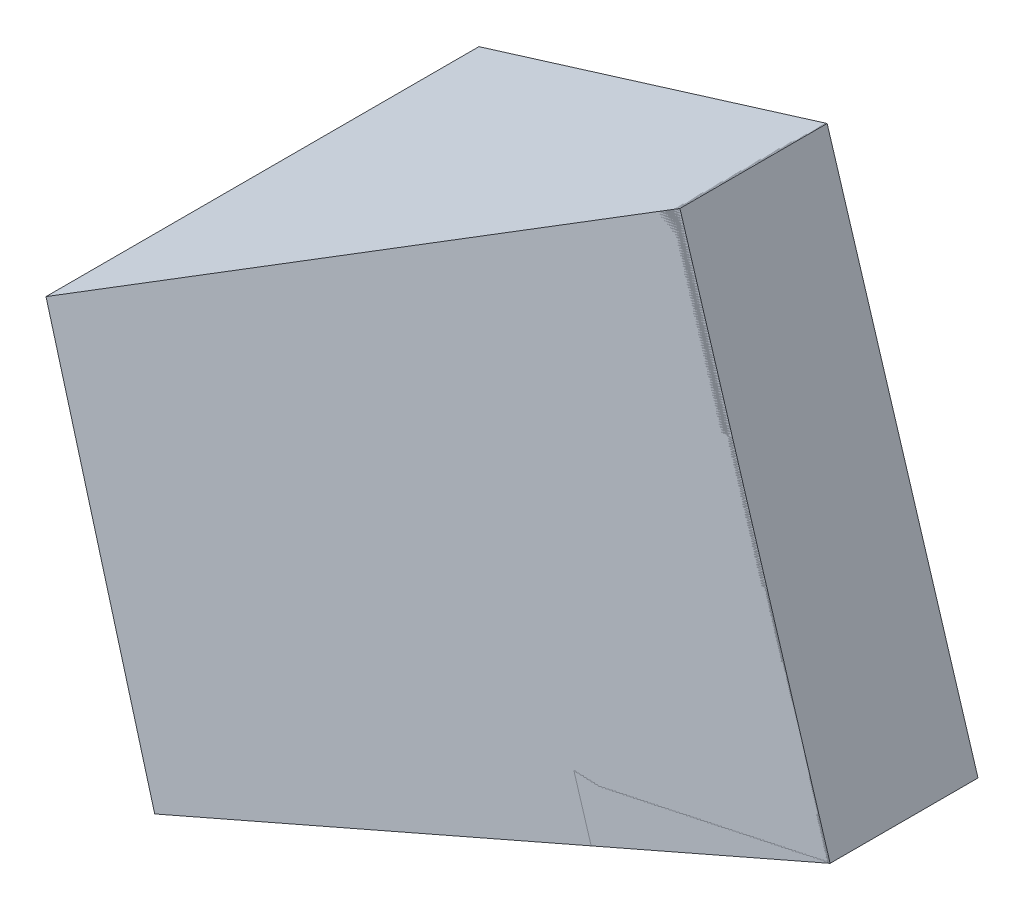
SolidWorks part; units mm, degrees
ref_plane "Ebene Unten" through (0, 0, 0) normal (0, 0, 1) x (1, 0, 0)
ref_plane "Ebene Links" through (0, 0, 0) normal (0, 1, 0) x (1, 0, 0)
ref_plane "Ebene Vorne" through (0, 0, 0) normal (1, 0, 0) x (0, 0, -1)
sketch "Skizze1" plane through (0, 0, 0) normal (0, 0, 1) x (1, 0, 0)
  point P0 (250606.2, 448428.6)
  point P1 (250000, 450000)
  point P2 (249999, 449992.6)
  point P3 (249760.3, 449928.9)
  point P4 (250575.7, 448033.6)
  point P5 (250000.5, 449998.1)
  point P6 (250001.1, 449997)
  point P7 (250001.5, 449996.9)
  point P8 (250001.5, 449996.2)
  point P9 (250001.7, 449995.9)
  point P10 (250001.8, 449994.8)
  point P11 (250002.1, 449992.8)
  point P12 (250002.7, 449993.2)
  point P13 (250018.6, 449926.8)
  point P14 (250088.7, 449685.1)
  point P15 (250158.9, 449444.7)
  point P16 (250229.1, 449204.7)
  point P17 (250299.4, 448964.8)
  point P18 (250369.4, 448724.8)
  point P19 (250439.7, 448484.8)
  point P20 (250510, 448244.8)
  point P21 (250571.6, 448037.1)
  point P22 (250571, 448035.4)
  point P23 (250571.2, 448034.3)
  point P24 (250571.1, 448033.6)
  point P25 (250571, 448033.1)
  point P26 (250571, 448032.8)
  point P27 (250571.3, 448032.3)
  point P28 (250571.5, 448031.8)
  point P29 (250230.1, 449215.3)
  point P30 (250159.8, 449454.9)
  point P31 (250089.5, 449694.2)
  point P32 (250019.3, 449933)
  point P33 (249261.2, 449768.2)
  point P34 (250332.7, 450100)
  point P35 (249500, 449842)
  point P36 (249738.8, 449916.1)
  point P37 (249977.6, 449989.9)
  point P38 (250216.5, 450063.3)
  point P39 (252079.1, 449480)
  point P40 (250390.3, 447750.8)
  point P41 (252152.2, 449241.9)
  point P42 (252226.1, 449003.1)
  point P43 (252297.6, 448763.5)
  point P44 (252371.2, 448524)
  point P45 (252446, 448285)
  point P46 (252434.3, 448059.4)
  point P47 (252185.1, 448055.2)
  point P48 (251938.3, 448050.3)
  point P49 (251688.5, 448046.6)
  point P50 (251434.7, 448044)
  point P51 (251183.8, 448041.7)
  point P52 (250933.7, 448039.4)
  point P53 (250684.2, 448036.8)
  point P54 (250481.1, 447891.8)
  point P55 (250346, 447681.5)
  point P56 (251966.4, 448968.6)
  point P57 (250453, 448500.4)
  point P58 (252214.5, 449044)
  point P59 (252212.5, 449049.2)
  point P60 (252211.8, 449049.5)
  point P61 (252212.5, 449049.7)
  point P62 (252028.4, 448992.7)
  point P63 (251839.8, 448934.3)
  point P64 (251650, 448875.6)
  point P65 (251460, 448816.9)
  point P66 (251272.7, 448758.8)
  point P67 (251084, 448700.5)
  point P68 (250895.3, 448642.1)
  point P69 (250706.4, 448583.7)
  point P70 (250517.9, 448525.3)
  point P71 (250329.8, 448467.2)
  point P72 (250141.4, 448408.9)
  point P73 (249952.8, 448350.6)
  point P74 (249725.4, 448280.3)
  point P75 (249486.5, 448206.4)
  point P76 (249249.6, 448133.2)
  point P77 (249062, 448075.2)
  point P78 (248874.2, 448017.1)
  point P79 (248707.5, 447965.5)
  point P80 (248515, 447905.8)
  point P81 (250606.2, 448428.6)
curve "Importierte Kurve1"
curve "Importierte Kurve2"
curve "Importierte Kurve3"
curve "Importierte Kurve4"
curve "Importierte Kurve5"
curve "Importierte Kurve6"
curve "Importierte Kurve7"
curve "Importierte Kurve8"
curve "Importierte Kurve9"
curve "Importierte Kurve10"
curve "Importierte Kurve11"
curve "Importierte Kurve12"
curve "Importierte Kurve13"
curve "Importierte Kurve14"
curve "Importierte Kurve15"
curve "Importierte Kurve16"
curve "Importierte Kurve17"
curve "Importierte Kurve18"
curve "Importierte Kurve19"
curve "Importierte Kurve20"
curve "Importierte Kurve21"
curve "Importierte Kurve22"
curve "Importierte Kurve23"
curve "Importierte Kurve24"
curve "Importierte Kurve25"
curve "Importierte Kurve26"
curve "Importierte Kurve27"
curve "Importierte Kurve28"
curve "Importierte Kurve29"
curve "Importierte Kurve30"
curve "Importierte Kurve31"
curve "Importierte Kurve32"
curve "Importierte Kurve33"
curve "Importierte Kurve34"
curve "Importierte Kurve36"
curve "Importierte Kurve37"
curve "Importierte Kurve38"
curve "Importierte Kurve39"
curve "Importierte Kurve40"
curve "Importierte Kurve41"
curve "Importierte Kurve42"
curve "Importierte Kurve43"
curve "Importierte Kurve44"
curve "Importierte Kurve46"
curve "Importierte Kurve47"
curve "Importierte Kurve48"
curve "Importierte Kurve49"
curve "Importierte Kurve50"
curve "Importierte Kurve51"
curve "Importierte Kurve52"
curve "Importierte Kurve53"
curve "Importierte Kurve54"
curve "Importierte Kurve55"
curve "Importierte Kurve56"
curve "Importierte Kurve57"
curve "Importierte Kurve58"
curve "Importierte Kurve59"
curve "Importierte Kurve60"
curve "Importierte Kurve62"
curve "Importierte Kurve63"
curve "Importierte Kurve64"
curve "Importierte Kurve65"
curve "Importierte Kurve66"
curve "Importierte Kurve67"
curve "Importierte Kurve68"
curve "Importierte Kurve69"
curve "Importierte Kurve70"
curve "Importierte Kurve71"
curve "Importierte Kurve72"
curve "Importierte Kurve73"
curve "Importierte Kurve74"
curve "Importierte Kurve75"
ref_plane "Wand Rechts" through (-5742.9829, 444725.4153, 0) normal (-0.0129, 0.9999, 0) x (0.9999, 0.0129, 0)
ref_plane "Wand Links" through (-105120.47, 340296.7975, 0) normal (0.2951, -0.9555, 0) x (-0.9555, -0.2951, 0)
ref_plane "Trempel" through (356478.474, 109449.3323, 0) normal (-0.956, -0.2935, 0) x (0, 0, 1)
ref_plane "Dachschräge" through (136209.447, 42076.2146, 181823.4726) normal (-0.5895, -0.1821, -0.787) x (0.7928, -0.317, -0.5206)
ref_plane "Front" through (351466.9759, 102681.8502, 0) normal (0.9599, 0.2804, 0) x (0, 0, -1)
other "Schneiden1"
shell "Wandung1" thickness 30
surface "Decke" parameters "D1"=0
surface "WandL" parameters "D1"=0
surface "WandR" parameters "D1"=0
ref_plane "Ebene1" through (355847.5424, 109255.6178, 0) normal (-0.956, -0.2935, 0) x (0, 0, 1)
other "Oberflächenschnitt1"
sketch "Skizze2" plane through (251754.1711, 450538.2992, 0) normal (0, 0, 1) x (0.956, 0.2935, 0)
  line L0 (0, 0) -> (-1837.6274, -3.1536) construction
  line L1 (0, -2592.0181) -> (0, 0) construction
  line L2 (-1865.5106, -2045.5089) -> (0, -2592.0181) construction
  line L3 (0, 0) -> (-1837.6274, -3.1536)
  line L4 (0, -2592.0181) -> (0, 0)
  line L5 (-1865.5106, -2045.5089) -> (0, -2592.0181)
  line L6 (-1837.6274, -3.1536) -> (-1865.5106, -2045.5089) construction
  line L7 (-1837.6274, -3.1536) -> (-1865.5106, -2045.5089)
surface "Oberfläche-Ebene1" sketch "Skizze2"
